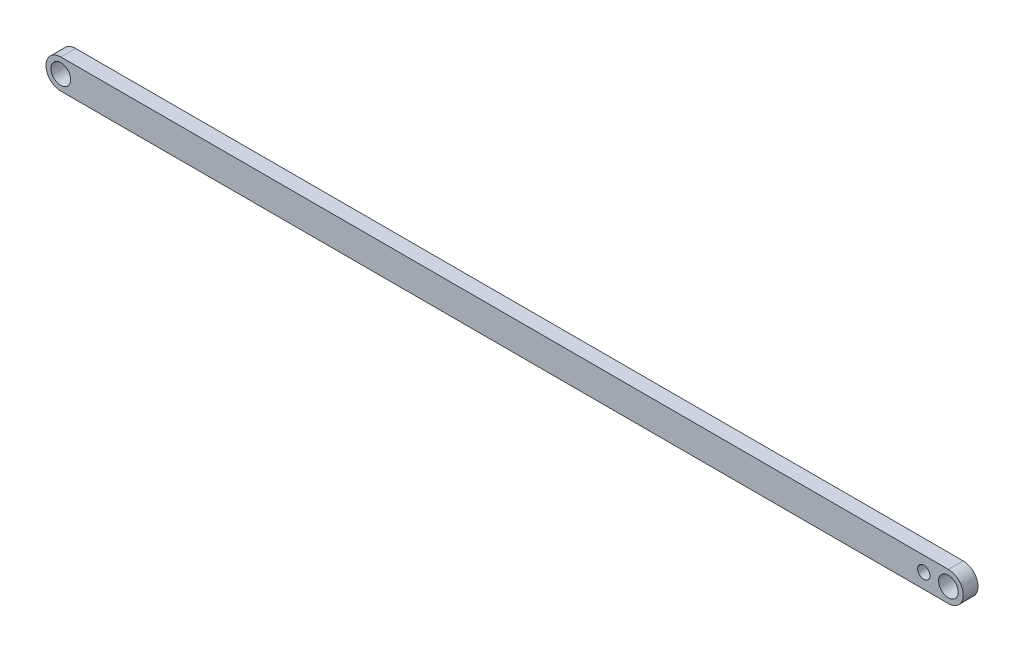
SolidWorks part; units mm, degrees
ref_plane "Face" through (0, 0, 0) normal (0, 0, 1) x (1, 0, 0)
ref_plane "Dessus" through (0, 0, 0) normal (0, 1, 0) x (1, 0, 0)
ref_plane "Droite" through (0, 0, 0) normal (1, 0, 0) x (0, 0, -1)
sketch "Esquisse1" plane through (0, 0, 0) normal (0, 0, 1) x (1, 0, 0)
  line L1 (0, 0) -> (1800, 0)
  line L3 (0, 60) -> (1800, 60)
  arc A0 (1800, 60) -> (1800, 0) centre (1800, 30) cw
  arc A1 (0, 0) -> (0, 60) centre (0, 30) cw
  circle A2 centre (0, 30) radius 20
  circle A3 centre (1800, 30) radius 20
  dimension "D1" = 30
  dimension "D3" = 40
  dimension "D2" = 1800
extrude "Extrusion1" add sketch "Esquisse1" along normal blind 30
sketch "Esquisse2" plane through (0, 0, 30) normal (0, 0, 1) x (1, 0, 0)
  line L0 (0, 0) -> (1800, 0) construction
  circle A0 centre (1750, 30) radius 12.5
  circle A1 centre (1800, 30) radius 20 construction
  dimension "D1" = 25
  dimension "D2" = 50
  dimension "D3" = 30
extrude "Enlèv. mat.-Extru.1" cut sketch "Esquisse2" against normal through all
